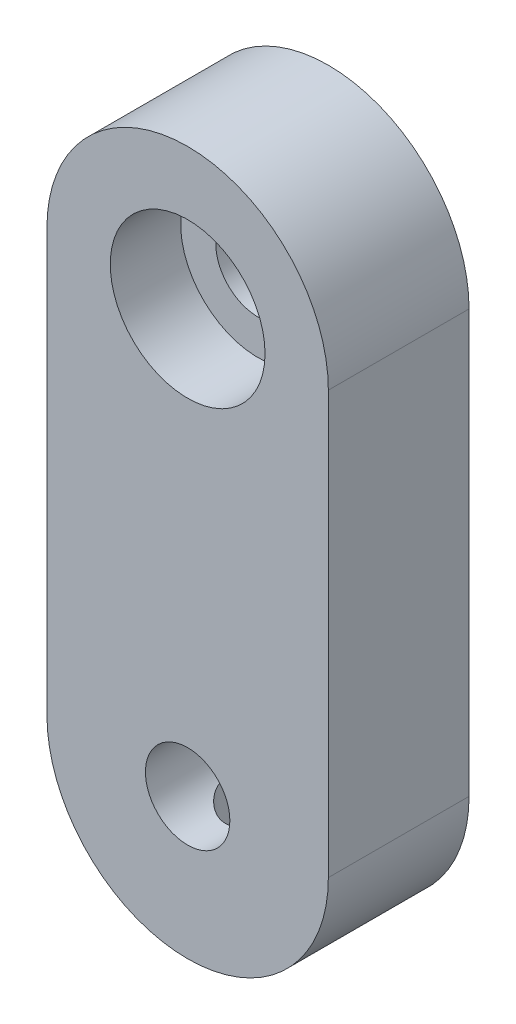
SolidWorks part; units mm, degrees
ref_plane "Front Plane" through (0, 0, 0) normal (0, 0, 1) x (1, 0, 0)
ref_plane "Top Plane" through (0, 0, 0) normal (0, 1, 0) x (1, 0, 0)
ref_plane "Right Plane" through (0, 0, 0) normal (1, 0, 0) x (0, 0, -1)
sketch "Sketch1" plane through (0, 0, 0) normal (0, 0, 1) x (1, 0, 0)
  line L0 (0, 0) -> (0, 30) construction
  line L1 (10, 0) -> (10, 30)
  line L2 (-10, 0) -> (-10, 30)
  circle A0 centre (0, 30) radius 3
  circle A1 centre (0, 0) radius 3
  arc A2 (-10, 0) -> (10, 0) centre (0, 0) ccw
  arc A3 (10, 30) -> (-10, 30) centre (0, 30) ccw
  dimension "D2" = 6
  dimension "D3" = 20
  dimension "D4" = 20
  dimension "D1" = 30
extrude "Extrude1" add sketch "Sketch1" along normal blind 10
sketch "Sketch2" plane through (0, 0, 0) normal (0, 1, 0) x (1, 0, 0)
  line L0 (0, 0) -> (0, -10) construction
  line L1 (-10, -10) -> (10, -10) construction
  circle A0 centre (0, -5.3251) radius 2
  dimension "D1" = 4
extrude "Extrude2" cut sketch "Sketch2" against normal through all
sketch "Sketch3" plane through (0, 0, 10) normal (0, 0, 1) x (1, 0, 0)
  circle A0 centre (0, 30) radius 5.5
  dimension "D1" = 11
extrude "Cut-Extrude1" cut sketch "Sketch3" against normal blind 5
